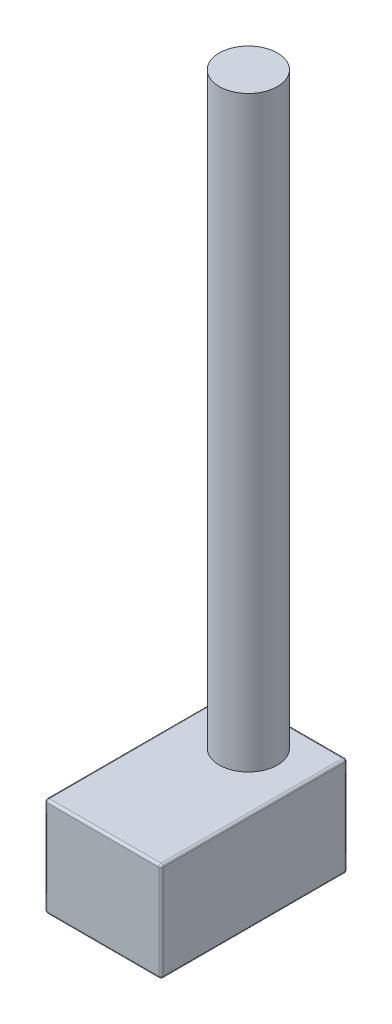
SolidWorks part; units mm, degrees
ref_plane "Front Plane" through (0, 0, 0) normal (0, 0, 1) x (1, 0, 0)
ref_plane "Top Plane" through (0, 0, 0) normal (0, 1, 0) x (1, 0, 0)
ref_plane "Right Plane" through (0, 0, 0) normal (1, 0, 0) x (0, 0, -1)
sketch "Sketch1" plane through (0, 0, 0) normal (0, 1, 0) x (1, 0, 0)
  line L1 (-60.0097, 18.558) -> (39.9903, 18.558)
  line L2 (-60.0097, 18.558) -> (-60.0097, -141.442)
  line L3 (-60.0097, -141.442) -> (39.9903, -141.442)
  line L4 (39.9903, 18.558) -> (39.9903, -141.442)
  dimension "D1" = 100
  dimension "D2" = 160
extrude "Boss-Extrude1" add sketch "Sketch1" along normal blind 85
sketch "Sketch2" plane through (0, 0, 0) normal (0, 1, 0) x (1, 0, 0)
  line L0 (-60.0097, 18.558) -> (39.9903, 18.558) construction
  line L3 (-60.0097, 18.558) -> (-60.0097, -141.442) construction
  circle A0 centre (-10.0097, -16.442) radius 25
  dimension "D1" = 35
  dimension "D2" = 50
  dimension "D3" = 50
extrude "Boss-Extrude2" add sketch "Sketch2" along normal blind 590
sketch "Sketch4" plane through (-60.0097, 0, 0) normal (-1, 0, 0) x (0, 0, 1)
  line L0 (-18.558, 0) -> (141.442, 0) construction
  line L1 (53.6781, 0) -> (78.6781, 0)
  line L2 (53.6781, 0) -> (53.6781, 82)
  line L3 (53.6781, 82) -> (78.6781, 82)
  line L4 (78.6781, 0) -> (78.6781, 82)
  line L5 (53.6781, 0) -> (78.6781, 82) construction
  line L6 (53.6781, 82) -> (78.6781, 0) construction
  point P0 (66.1781, 41)
  dimension "D1" = 82
  dimension "D2" = 25
extrude "Cut-Extrude1" cut sketch "Sketch4" against normal blind 70
fillet "Fillet3" radius 2 3 edges at (-60.0097, 41, 53.6781) (-60.0097, 41, 78.6781) (-60.0097, 82, 66.1781)
fillet "Fillet4" radius 5 1 edges at (9.9903, 82, 66.1781)
fillet "Fillet5" radius 2 4 edges at (-10.0097, 85, -18.558) (39.9903, 85, 61.442) (-60.0097, 85, 61.442) (-10.0097, 85, 141.442)
fillet "Fillet6" radius 2 17 edges at (-59.4239, 84.4142, -17.9722) (-24.0097, 0, 78.6781) (-59.4239, 0, 79.2639) (-24.0097, 0, 53.6781) (-59.4239, 0, 53.0923) (39.4046, 84.4142, -17.9722) (39.4046, 84.4142, 140.8562) (-59.4239, 84.4142, 140.8562) (-60.0097, 41.5, -18.558) (-60.0097, 0, 111.06) (-60.0097, 0, 16.56) (-10.0097, 0, -18.558) (39.9903, 41.5, -18.558) (39.9903, 0, 61.442) (39.9903, 41.5, 141.442) (-60.0097, 41.5, 141.442) (-10.0097, 0, 141.442)
